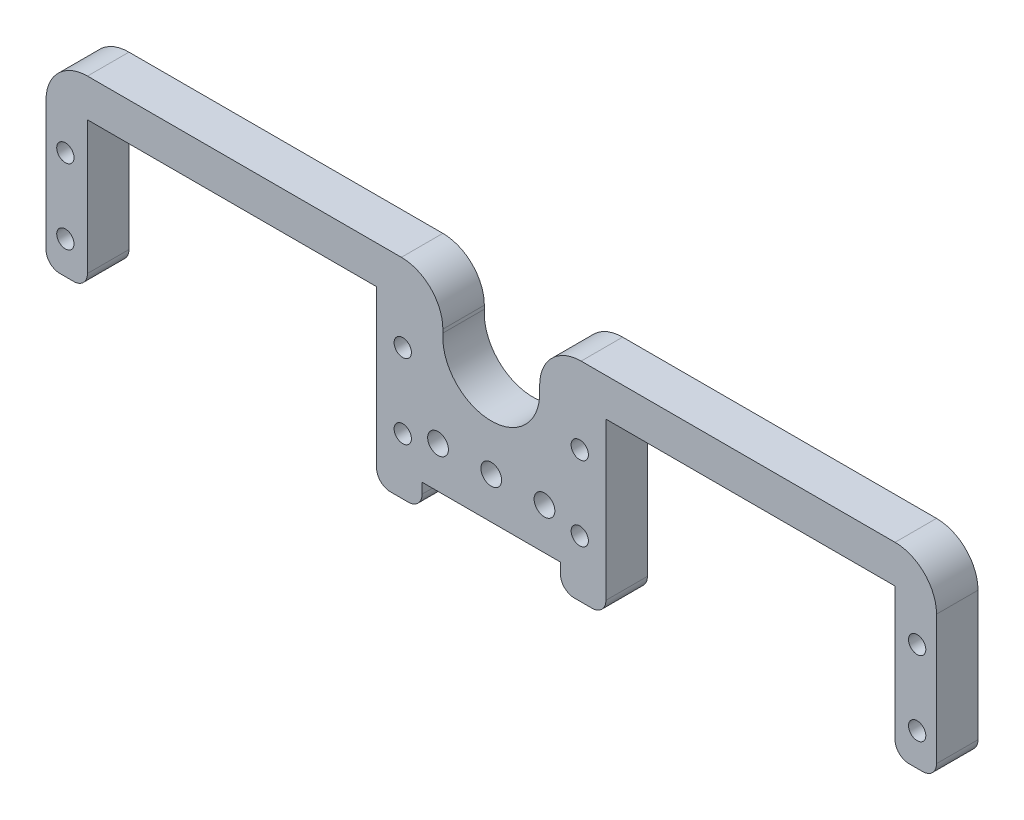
SolidWorks part; units mm, degrees
ref_plane "Front Plane" through (0, 0, 0) normal (0, 0, 1) x (1, 0, 0)
ref_plane "Top Plane" through (0, 0, 0) normal (0, 1, 0) x (1, 0, 0)
ref_plane "Right Plane" through (0, 0, 0) normal (1, 0, 0) x (0, 0, -1)
sketch "Sketch1" plane through (0, 0, 0) normal (0, 0, 1) x (1, 0, 0)
  line L0 (164.9422, 12.6454) -> (166.9422, 12.6454)
  line L1 (168.9422, 14.6454) -> (168.9422, 32.8954)
  line L2 (162.9422, 14.6454) -> (162.9422, 33.3705)
  line L3 (168.9422, 39.3705) -> (214.3422, 39.3705)
  line L4 (168.9422, 32.8954) -> (168.9422, 33.8954)
  line L5 (168.9422, 33.8954) -> (210.7559, 33.8954)
  line L6 (227.3422, 39.3705) -> (227.3422, 25.3705) construction
  line L7 (217.3422, 12.6986) -> (237.3422, 12.6986)
  line L8 (210.7559, 33.8954) -> (210.7559, 11.1986)
  line L9 (212.7559, 9.1986) -> (215.3422, 9.1986)
  line L10 (217.3422, 11.1986) -> (217.3422, 12.6986)
  line L11 (237.3422, 11.1986) -> (237.3422, 12.6986)
  line L12 (241.9284, 9.1986) -> (239.3422, 9.1986)
  line L13 (243.9284, 33.8954) -> (243.9284, 11.1986)
  line L14 (285.7422, 33.8954) -> (243.9284, 33.8954)
  line L15 (285.7422, 32.8954) -> (285.7422, 33.8954)
  line L16 (285.7422, 14.6454) -> (285.7422, 32.8954)
  line L17 (289.7422, 12.6454) -> (287.7422, 12.6454)
  line L18 (291.7422, 14.6454) -> (291.7422, 33.3705)
  line L19 (220.3422, 32.8738) -> (220.3422, 33.3705)
  line L20 (234.3422, 32.8738) -> (234.3422, 33.3705)
  line L21 (240.3422, 39.3705) -> (285.7422, 39.3705)
  circle A0 centre (214.5422, 17.3754) radius 1.25
  circle A1 centre (214.5422, 28.1654) radius 1.25
  circle A2 centre (165.7422, 28.1654) radius 1.25
  circle A3 centre (165.7422, 17.3754) radius 1.25
  arc A4 (220.3422, 32.8738) -> (234.3422, 32.8738) centre (227.3422, 32.3874) ccw
  circle A5 centre (219.6442, 18.6986) radius 1.5
  circle A6 centre (227.3422, 18.6986) radius 1.5
  circle A7 centre (235.0401, 18.6986) radius 1.5
  circle A8 centre (240.1422, 17.3754) radius 1.25
  circle A9 centre (240.1422, 28.1654) radius 1.25
  circle A10 centre (288.9422, 17.3754) radius 1.25
  circle A11 centre (288.9422, 28.1654) radius 1.25
  arc A12 (240.3422, 39.3705) -> (234.3422, 33.3705) centre (240.3422, 33.3705) ccw
  arc A13 (220.3422, 33.3705) -> (214.3422, 39.3705) centre (214.3422, 33.3705) ccw
  arc A14 (162.9422, 33.3705) -> (168.9422, 39.3705) centre (168.9422, 33.3705) cw
  arc A15 (291.7422, 33.3705) -> (285.7422, 39.3705) centre (285.7422, 33.3705) ccw
  arc A16 (239.3422, 9.1986) -> (237.3422, 11.1986) centre (239.3422, 11.1986) cw
  arc A17 (217.3422, 11.1986) -> (215.3422, 9.1986) centre (215.3422, 11.1986) cw
  arc A18 (168.9422, 14.6454) -> (166.9422, 12.6454) centre (166.9422, 14.6454) cw
  arc A19 (285.7422, 14.6454) -> (287.7422, 12.6454) centre (287.7422, 14.6454) ccw
  arc A20 (291.7422, 14.6454) -> (289.7422, 12.6454) centre (289.7422, 14.6454) cw
  arc A21 (164.9422, 12.6454) -> (162.9422, 14.6454) centre (164.9422, 14.6454) cw
  arc A22 (243.9284, 11.1986) -> (241.9284, 9.1986) centre (241.9284, 11.1986) cw
  arc A23 (212.7559, 9.1986) -> (210.7559, 11.1986) centre (212.7559, 11.1986) cw
  point P29 (227.3422, 12.6986)
  point P50 (234.3422, 39.3705)
  point P53 (220.3422, 39.3705)
  point P56 (162.9422, 39.3705)
  point P59 (291.7422, 39.3705)
  point P62 (237.3422, 9.1986)
  point P65 (217.3422, 9.1986)
  point P68 (168.9422, 12.6454)
  point P71 (285.7422, 12.6454)
  point P74 (291.7422, 12.6454)
  point P77 (162.9422, 12.6454)
  point P80 (243.9284, 9.1986)
  point P83 (210.7559, 9.1986)
  dimension "D1" = 6
  dimension "D2" = 6
  dimension "D3" = 2
  dimension "D4" = 2
extrude "Boss-Extrude1" add sketch "Sketch1" along normal blind 6
